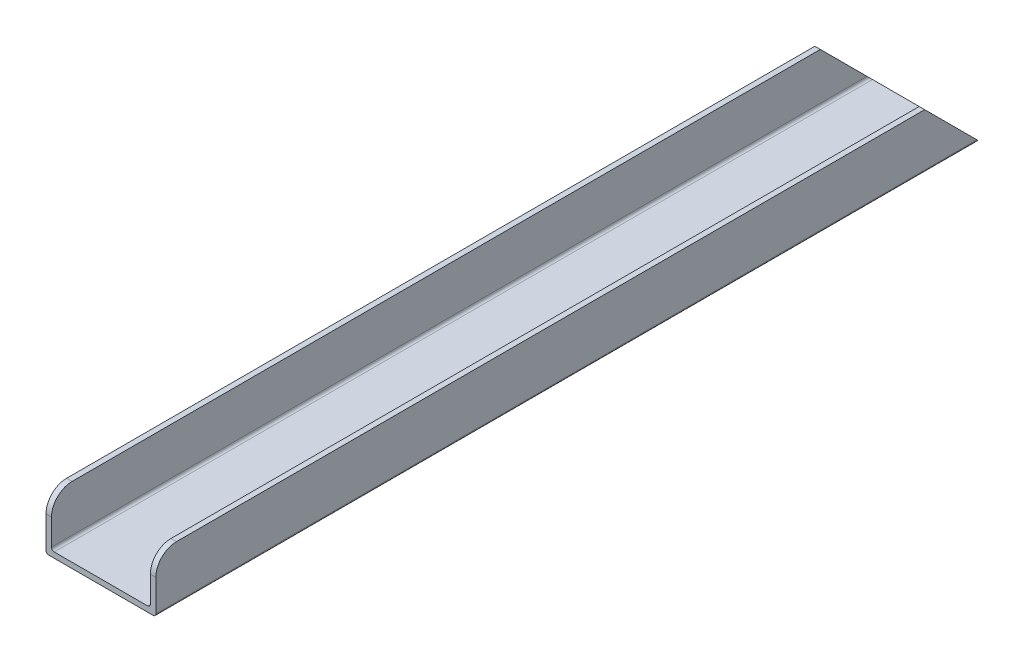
SolidWorks part; units mm, degrees
ref_plane "Plan de face" through (0, 0, 0) normal (0, 0, 1) x (1, 0, 0)
ref_plane "Plan de dessus" through (0, 0, 0) normal (0, 1, 0) x (1, 0, 0)
ref_plane "Plan de droite" through (0, 0, 0) normal (1, 0, 0) x (0, 0, -1)
sketch "Esquisse1" plane through (0, 0, 0) normal (0, 0, 1) x (1, 0, 0)
  line L0 (-38, 0) -> (38, 0)
  line L1 (40, 2) -> (40, 40)
  line L2 (40, 40) -> (36, 40)
  line L3 (36, 40) -> (36, 6)
  line L4 (34, 4) -> (-34, 4)
  line L5 (-36, 6) -> (-36, 40)
  line L6 (-36, 40) -> (-40, 40)
  line L7 (-40, 40) -> (-40, 2)
  arc A0 (-38, 0) -> (-40, 2) centre (-38, 2) cw
  arc A1 (38, 0) -> (40, 2) centre (38, 2) ccw
  arc A2 (36, 6) -> (34, 4) centre (34, 6) cw
  arc A3 (-34, 4) -> (-36, 6) centre (-34, 6) cw
  point P10 (-38, 40)
  point P13 (-40, 0)
  point P16 (40, 0)
  dimension "D8" = 2
  dimension "D1" = 40
  dimension "D2" = 40
  dimension "D3" = 4
  dimension "D4" = 4
  dimension "D5" = 4
  dimension "D6" = 40
  dimension "D7" = 40
extrude "Boss.-Extru.1" add sketch "Esquisse1" along normal blind 600
sketch "Esquisse2" plane through (-40, 0, 0) normal (-1, 0, 0) x (0, 0, 1)
  line L0 (0, 0) -> (40, 40)
  line L1 (600, 40) -> (0, 40) construction
  line L2 (0, 40) -> (0, 2) construction
  dimension "D1" = 45
extrude "Enlèv. mat.-Extru.1" cut sketch "Esquisse2" against normal through all and the other way through all
fillet "Congé1" radius 15 2 edges at (-38, 40, 600) (38, 40, 600)
